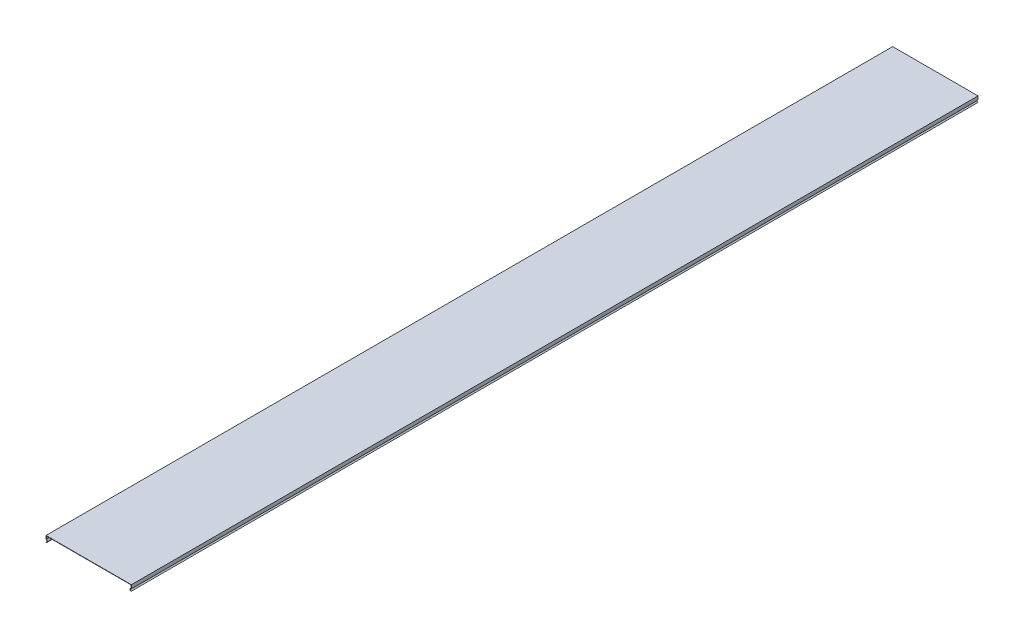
SolidWorks part; units mm, degrees
ref_plane "Front Plane" through (0, 0, 0) normal (0, 0, 1) x (1, 0, 0)
ref_plane "Top Plane" through (0, 0, 0) normal (0, 1, 0) x (1, 0, 0)
ref_plane "Right Plane" through (0, 0, 0) normal (1, 0, 0) x (0, 0, -1)
sketch "Sketch1" plane through (0, 0, 0) normal (0, 0, 1) x (1, 0, 0)
  line L0 (0, 0) -> (302.428, 0)
  line L1 (302.428, 0) -> (302.428, -12.428)
  line L2 (0, 0) -> (0, -12.428)
  line L3 (1.214, -1.214) -> (1.214, -11.3636)
  line L4 (1.214, -1.214) -> (301.214, -1.214)
  line L5 (301.214, -1.214) -> (301.214, -11.3636)
  line L6 (0, -20) -> (1.0931, -21.0931)
  line L7 (302.428, -20) -> (301.3349, -21.0931)
  arc A0 (302.428, -12.428) -> (302.428, -20) centre (302.428, -16.214) ccw
  arc A1 (0, -12.428) -> (0, -20) centre (0, -16.214) cw
  arc A2 (1.214, -11.3636) -> (1.0931, -21.0931) centre (0, -16.214) cw
  arc A3 (301.214, -11.3636) -> (301.3349, -21.0931) centre (302.428, -16.214) ccw
  arc A4 (1.214, -11.3636) -> (0, -21.214) centre (0, -16.214) cw construction
  arc A5 (301.214, -11.3636) -> (302.428, -21.214) centre (302.428, -16.214) ccw construction
  dimension "D3" = 5
  dimension "D2" = 302.428
  dimension "D4" = 15
  dimension "D5" = 135
  dimension "D6" = 135
  dimension "D1" = 1.214
extrude "Extrude1" add sketch "Sketch1" along normal blind 3000
